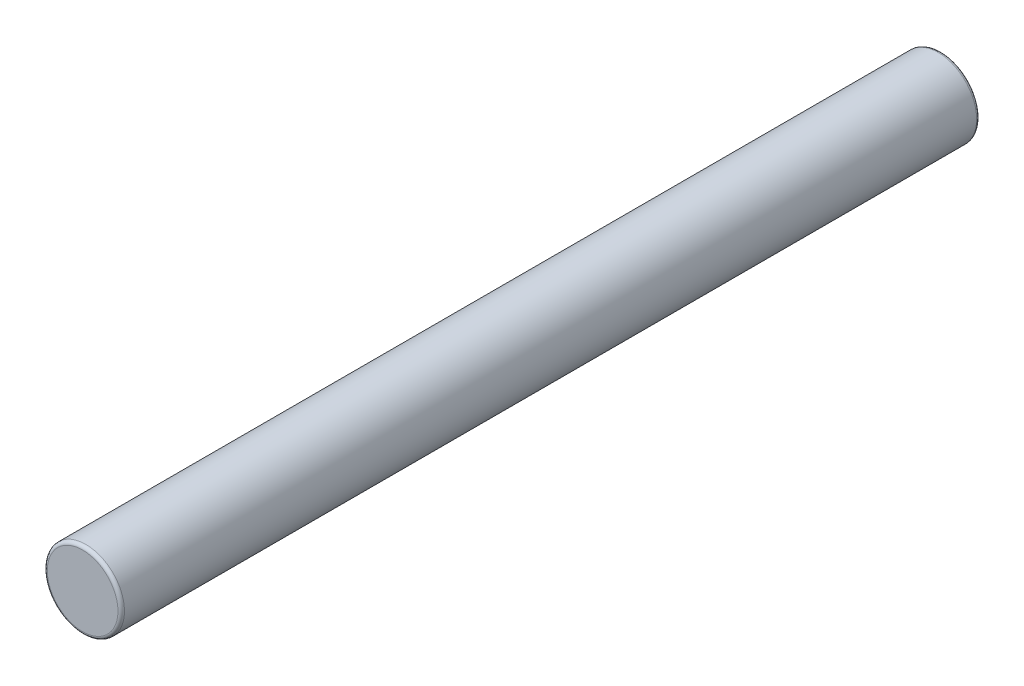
SolidWorks part; units mm, degrees
ref_plane "Front Plane" through (0, 0, 0) normal (0, 0, 1) x (1, 0, 0)
ref_plane "Top Plane" through (0, 0, 0) normal (0, 1, 0) x (1, 0, 0)
ref_plane "Right Plane" through (0, 0, 0) normal (1, 0, 0) x (0, 0, -1)
sketch "Sketch1" plane through (0, 0, 0) normal (0, 0, 1) x (1, 0, 0)
  circle A0 centre (0, 0) radius 1.505
  dimension "D1" = 3.0099
extrude "Extrude1" add sketch "Sketch1" along normal mid plane 33.4772
fillet "Fillet1" radius 0.127 2 edges at (1.505, 0, 16.7386) (1.505, 0, -16.7386)
